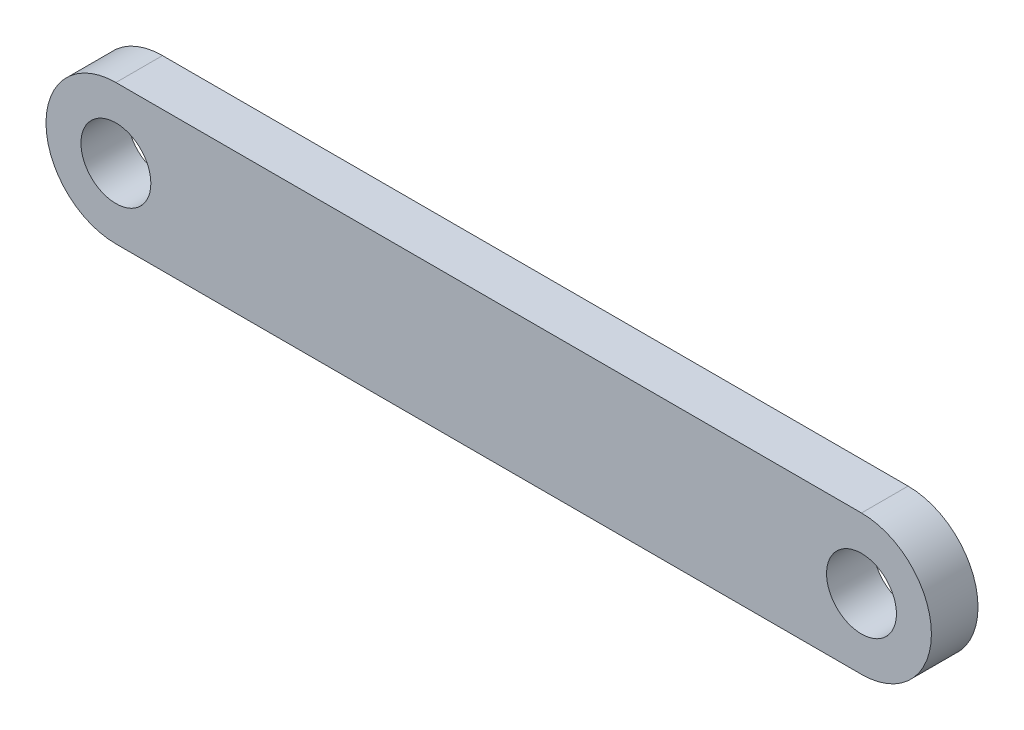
SolidWorks part; units mm, degrees
ref_plane "Plane1" through (0, 0, 0) normal (0, 0, 1) x (1, 0, 0)
ref_plane "Plane2" through (0, 0, 0) normal (0, 1, 0) x (1, 0, 0)
ref_plane "Plane3" through (0, 0, 0) normal (1, 0, 0) x (0, 0, -1)
sketch "Sketch1" plane through (0, 0, 0) normal (0, 0, 1) x (1, 0, 0)
  line L0 (0, 19.05) -> (203.2, 19.05)
  line L2 (203.2, -19.05) -> (0, -19.05)
  arc A0 (203.2, 19.05) -> (203.2, -19.05) centre (203.2, 0) cw
  arc A1 (0, 19.05) -> (0, -19.05) centre (0, 0) ccw
  circle A2 centre (203.2, 0) radius 9.525
  circle A3 centre (0, 0) radius 9.525
  dimension "D1" = 19.05
  dimension "D3" = 19.05
  dimension "D4" = 19.05
  dimension "D2" = 203.2
extrude "Base-Extrude" add sketch "Sketch1" along normal mid plane 12.7
